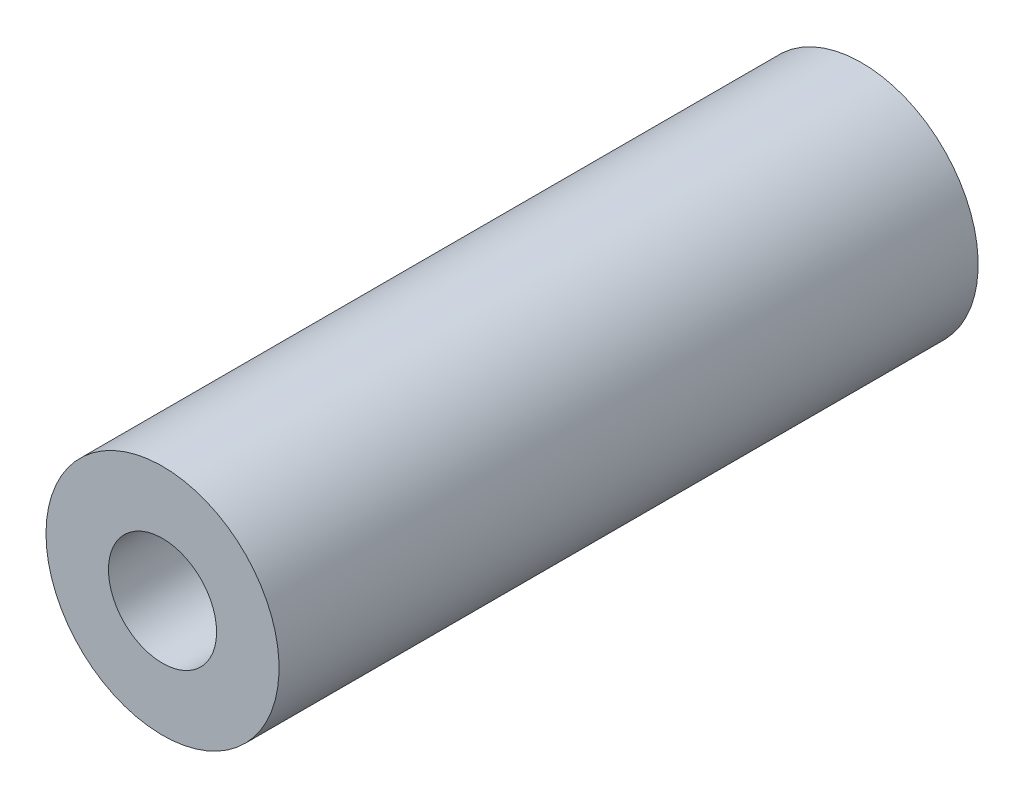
SolidWorks part; units mm, degrees
ref_plane "Front Plane" through (0, 0, 0) normal (0, 0, 1) x (1, 0, 0)
ref_plane "Top Plane" through (0, 0, 0) normal (0, 1, 0) x (1, 0, 0)
ref_plane "Right Plane" through (0, 0, 0) normal (1, 0, 0) x (0, 0, -1)
sketch "Sketch1" plane through (0, 0, 0) normal (0, 0, 1) x (1, 0, 0)
  circle A0 centre (0, 0) radius 3.175
  dimension "D1" = 6.35
extrude "Boss-Extrude1" add sketch "Sketch1" along normal blind 19.05
hole_wizard "#4 Clearance Hole1" positions "Sketch3" profile "Sketch2" hole size "#4" standard "ANSI Inch"
sketch "Sketch3" plane through (0, 0, 19.05) normal (0, 0, 1) x (1, 0, 0)
  point P0 (0, 0)
sketch "Sketch2" plane through (0, 0, 19.05) normal (1, 0, 0) x (0, -1, 0)
  line L0 (0, 0) -> (0, 19.05)
  line L1 (0, 19.05) -> (1.4732, 19.05)
  line L2 (1.4732, 19.05) -> (1.4732, 0)
  line L5 (1.4732, 0) -> (0, 0)
  line L11 (0, -6.35) -> (0, 107.95) construction
  dimension "Thru Hole Dia." = 2.9464
  dimension "Thru Hole Depth" = 19.05
